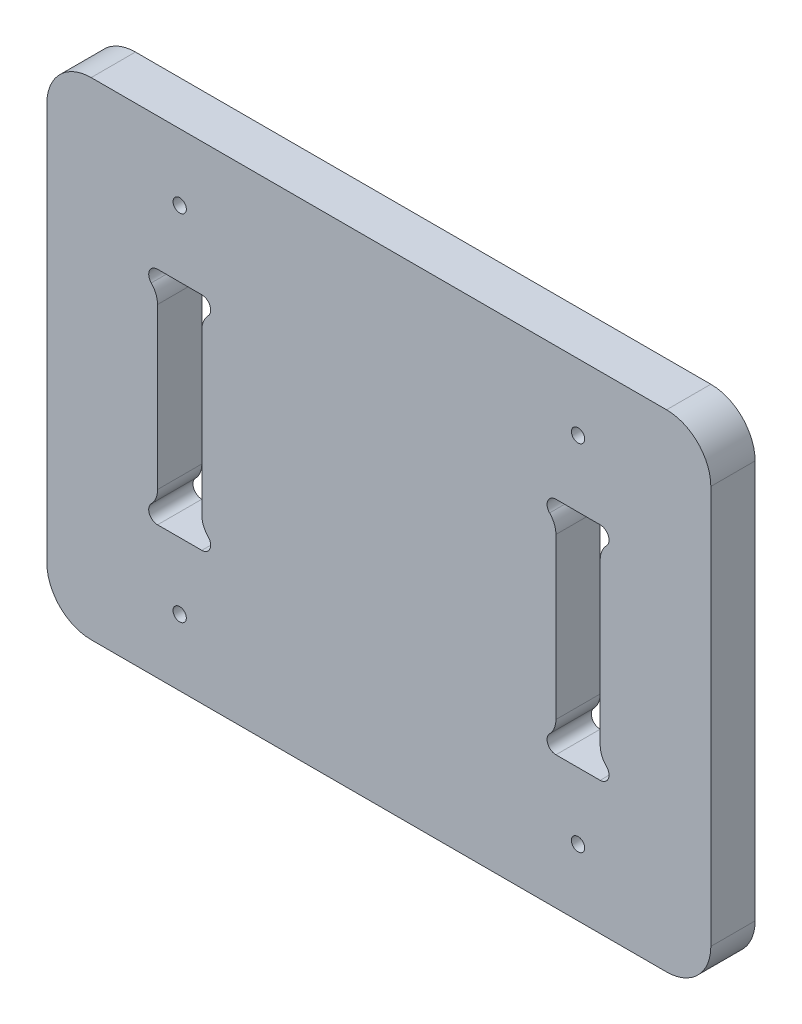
SolidWorks part; units mm, degrees
ref_plane "Plan de face" through (0, 0, 0) normal (0, 0, 1) x (1, 0, 0)
ref_plane "Plan de dessus" through (0, 0, 0) normal (0, 1, 0) x (1, 0, 0)
ref_plane "Plan de droite" through (0, 0, 0) normal (1, 0, 0) x (0, 0, -1)
sketch "Esquisse2" plane through (0, 0, 0) normal (0, 0, 1) x (1, 0, 0)
  line L1 (10, 110) -> (140, 110)
  line L2 (0, 100) -> (0, 10)
  line L3 (10, 0) -> (140, 0)
  line L4 (150, 100) -> (150, 10)
  arc A0 (10, 110) -> (0, 100) centre (10, 100) ccw
  arc A1 (0, 10) -> (10, 0) centre (10, 10) ccw
  arc A2 (140, 110) -> (150, 100) centre (140, 100) cw
  arc A3 (140, 0) -> (150, 10) centre (140, 10) ccw
  point P10 (0, 0)
  dimension "D3" = 10
  dimension "D4" = 10
  dimension "D5" = 10
  dimension "D1" = 150
  dimension "D2" = 110
extrude "Boss.-Extru.1" add sketch "Esquisse2" along normal blind 10
sketch "Esquisse1" plane through (0, 0, 0) normal (0, 0, 1) x (1, 0, 0)
  line L0 (35, 30) -> (25, 30)
  line L1 (25, 36.899) -> (25, 73.101)
  line L2 (25, 80) -> (35, 80)
  line L3 (30, -49.8826) -> (30, 125.6245) construction
  line L4 (35, 36.899) -> (35, 73.101)
  line L9 (0, 100) -> (0, 10) construction
  line L10 (10, 0) -> (140, 0) construction
  line L11 (150, 10) -> (150, 100) construction
  line L13 (125, 30) -> (115, 30)
  line L14 (115, 36.899) -> (115, 73.101)
  line L15 (115, 80) -> (125, 80)
  line L16 (125, 36.899) -> (125, 73.101)
  line L17 (120, -49.8826) -> (120, 125.6245) construction
  arc A0 (23.5714, 33.3997) -> (25, 30) centre (25, 32) ccw
  arc A1 (23.5714, 33.3997) -> (25, 36.899) centre (20, 36.899) ccw
  arc A2 (25, 73.101) -> (23.5714, 76.6003) centre (20, 73.101) ccw
  arc A3 (25, 80) -> (23.5714, 76.6003) centre (25, 78) ccw
  circle A4 centre (30, 15) radius 1.5
  arc A5 (36.4286, 33.3997) -> (35, 36.899) centre (40, 36.899) cw
  arc A6 (36.4286, 33.3997) -> (35, 30) centre (35, 32) cw
  arc A7 (35, 73.101) -> (36.4286, 76.6003) centre (40, 73.101) cw
  arc A8 (35, 80) -> (36.4286, 76.6003) centre (35, 78) cw
  circle A9 centre (30, 95) radius 1.5
  arc A20 (113.5714, 33.3997) -> (115, 30) centre (115, 32) ccw
  arc A21 (113.5714, 33.3997) -> (115, 36.899) centre (110, 36.899) ccw
  arc A22 (115, 73.101) -> (113.5714, 76.6003) centre (110, 73.101) ccw
  arc A23 (115, 80) -> (113.5714, 76.6003) centre (115, 78) ccw
  circle A24 centre (120, 15) radius 1.5
  arc A25 (126.4286, 33.3997) -> (125, 36.899) centre (130, 36.899) cw
  arc A26 (126.4286, 33.3997) -> (125, 30) centre (125, 32) cw
  arc A27 (125, 73.101) -> (126.4286, 76.6003) centre (130, 73.101) cw
  arc A28 (125, 80) -> (126.4286, 76.6003) centre (125, 78) cw
  circle A29 centre (120, 95) radius 1.5
  dimension "D5" = 2
  dimension "D7" = 5
  dimension "D8" = 2
  dimension "D9" = 5
  dimension "D2" = 30
  dimension "D3" = 15
  dimension "D4" = 15
  dimension "D6" = 10
  dimension "D10" = 50
  dimension "D11" = 10
  dimension "D12" = 10
  dimension "D13" = 2
  dimension "D14" = 25
  dimension "D15" = 25
extrude "Enlèv. mat.-Extru.1" cut sketch "Esquisse1" along normal blind 10
chamfer "Chanfrein1" distance 2.2 angle 45 4 edges at (118.5, 95, 0) (28.5, 95, 0) (121.5, 15, 0) (31.5, 15, 0)
